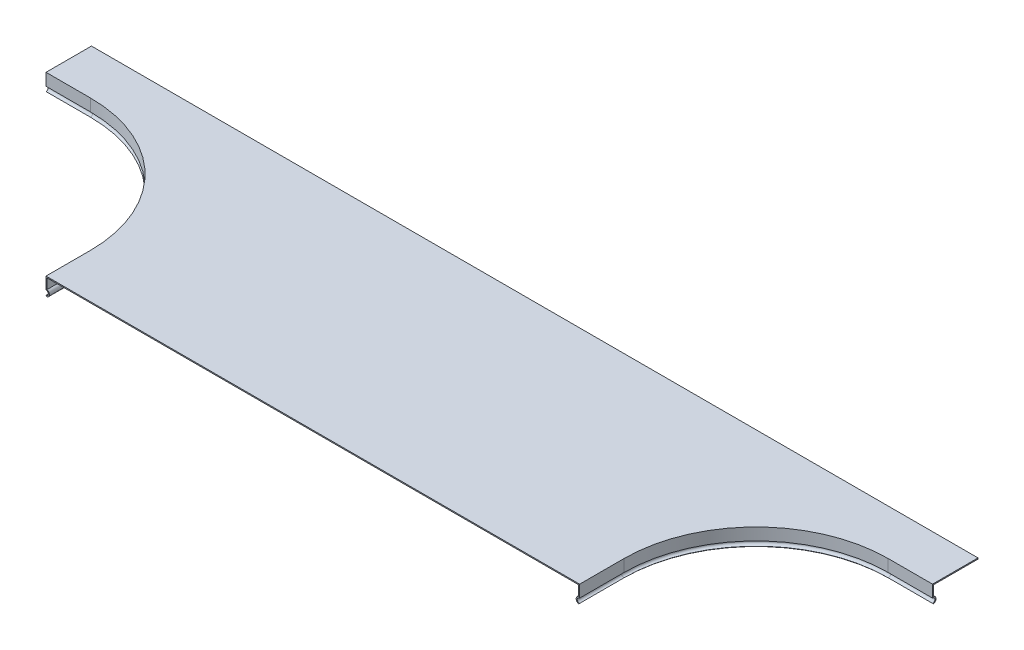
SolidWorks part; units mm, degrees
ref_plane "Front Plane" through (0, 0, 0) normal (0, 0, 1) x (1, 0, 0)
ref_plane "Top Plane" through (0, 0, 0) normal (0, 1, 0) x (1, 0, 0)
ref_plane "Right Plane" through (0, 0, 0) normal (1, 0, 0) x (0, 0, -1)
sketch "Sketch1" plane through (0, 0, 0) normal (0, 1, 0) x (1, 0, 0)
  line L0 (0, 0) -> (0, 50)
  line L1 (150, 200) -> (200, 200)
  arc A0 (0, 50) -> (150, 200) centre (150, 50) cw
  dimension "D2" = 150
  dimension "D1" = 50
sketch "Sketch2" plane through (0, 0, 0) normal (0, 0, 1) x (1, 0, 0)
  line L0 (0, 0) -> (0, -11.3622)
  line L1 (0, 0) -> (-298.786, 0)
  line L3 (-298.786, 0) -> (-298.786, 1.214)
  line L4 (-298.786, 1.214) -> (1.214, 1.214)
  line L5 (1.214, 1.214) -> (1.214, -12.4333)
  line L6 (1.214, -12.4333) -> (1.214, -36.5404) construction
  line L9 (1.214, -17.5667) -> (0.1123, -18.6684)
  line L10 (-50, 0) -> (-50, -15) construction
  line L11 (-51.214, 1.214) -> (-51.214, -16.5185) construction
  line L12 (1.214, 1.214) -> (-51.214, 1.214) construction
  line L13 (0, 0) -> (-50, 0) construction
  arc A0 (0, -11.3622) -> (0.1123, -18.6684) centre (1.0488, -15) ccw
  arc A3 (1.214, -12.4333) -> (1.214, -17.5667) centre (1.0488, -15) ccw
  arc A4 (-51.214, -16.5185) -> (-50, -21.358) centre (-50, -18.786) cw construction
  arc A5 (1.214, -12.4333) -> (2.9073, -13.222) centre (1.0488, -15) ccw construction
  arc A6 (-50, -15) -> (-50, -22.572) centre (-50, -18.786) cw construction
  arc A7 (0, -11.3622) -> (3.7845, -12.3828) centre (1.0488, -15) ccw construction
  dimension "D4" = 1.214
  dimension "D5" = 3.786
  dimension "D2" = 15
  dimension "D3" = 1.214
  dimension "D6" = 45
  dimension "D1" = 300
sweep "Sweep1" add profiles "Sketch2" path "Sketch1"
sketch "Sketch3" plane through (0, 0, 0) normal (0, 1, 0) x (1, 0, 0)
  line L0 (-298.786, 0) -> (-598.786, 0) construction
  line L1 (-748.786, 200) -> (-798.786, 200)
  line L3 (-598.786, 0) -> (-598.786, 50)
  arc A0 (-598.786, 50) -> (-748.786, 200) centre (-748.786, 50) ccw
  dimension "D2" = 150
  dimension "D1" = 50
  dimension "D3" = 300
sketch "Sketch4" plane through (0, 0, 0) normal (0, 0, 1) x (1, 0, 0)
  line L0 (-598.786, 0) -> (-598.786, -11.4139)
  line L1 (-598.786, 0) -> (-748.786, 0) construction
  line L2 (-298.786, 0) -> (-598.786, 0) construction
  line L3 (-598.786, 0) -> (-298.786, 0)
  line L4 (-298.786, 0) -> (-298.786, 1.214)
  line L5 (-298.786, 1.214) -> (-600, 1.214)
  line L6 (-600, 1.214) -> (-600, -12.428)
  line L7 (-600, -17.572) -> (-598.938, -18.634)
  line L8 (-600, -12.428) -> (-600, -31.5018) construction
  arc A0 (-598.786, -11.4139) -> (-598.938, -18.634) centre (-600, -15) cw
  arc A1 (-600, -12.428) -> (-600, -17.572) centre (-600, -15) cw
  dimension "D3" = 1.214
  dimension "D6" = 3.786
  dimension "D1" = 300
  dimension "D2" = 1.214
  dimension "D4" = 45
  dimension "D5" = 15
sweep "Sweep2" add profiles "Sketch4" path "Sketch3"
sketch "Sketch5" plane through (0, 1.214, 0) normal (0, 1, 0) x (1, 0, 0)
  line L0 (-798.393, 198.786) -> (-798.393, 250)
  line L1 (-299.393, 250) -> (-299.393, 48.786) construction
  line L2 (-798.393, 250) -> (199.607, 250)
  line L4 (199.607, 250) -> (199.607, 198.786)
  line L5 (199.607, 198.786) -> (-254.393, 198.786)
  line L6 (-299.393, 48.786) -> (-299.393, 0) construction
  line L7 (1.214, 0) -> (-600, 0) construction
  line L8 (150, 198.786) -> (200, 198.786) construction
  line L9 (-254.393, 198.786) -> (-254.393, 48.786)
  line L10 (-254.393, 48.786) -> (-299.393, 48.786)
  line L11 (-344.393, 48.786) -> (-344.393, 198.786)
  line L12 (-299.393, 48.786) -> (-344.393, 48.786)
  line L13 (-344.393, 198.786) -> (-798.393, 198.786)
  dimension "D1" = 998
  dimension "D2" = 250
  dimension "D3" = 150
  dimension "D4" = 45
extrude "Extrude1" add sketch "Sketch5" against normal blind 1.214
sketch "Sketch7" [suppressed] plane through (0, 1.214, 0) normal (0, 1, 0) x (1, 0, 0)
  line L0 (-198.786, 180) -> (-328.7871, 180)
  line L3 (-198.786, 180) -> (130.0025, 180)
extrude "Extrude2" [suppressed] cut sketch "Sketch7" against normal through all and the other way through all
sketch "Sketch8" [suppressed] plane through (0, 1.214, 0) normal (0, 1, 0) x (1, 0, 0)
  line L0 (-198.786, 180) -> (-428.786, 180)
  line L1 (-428.786, 280) -> (-428.786, 128.786) construction
  line L2 (-198.786, 180) -> (130, 180)
  line L3 (130, 128.786) -> (130, 278.786) construction
extrude "Extrude3" [suppressed] cut sketch "Sketch8" against normal through all and the other way through all
sketch "Sketch9" [suppressed] plane through (0, 1.214, 0) normal (0, 1, 0) x (1, 0, 0)
  line L0 (-302.3758, 250) -> (-698.786, 250)
  line L1 (-698.786, 450) -> (-698.786, 198.786) construction
  line L2 (-302.3758, 250) -> (200, 250)
  line L3 (200, 198.786) -> (200, 448.786) construction
extrude "Extrude4" [suppressed] cut sketch "Sketch9" against normal through all and the other way through all
sketch "Sketch10" plane through (0, 1.214, 0) normal (0, 1, 0) x (1, 0, 0)
  line L0 (-345.6731, 250) -> (-798.786, 250)
  line L1 (-798.786, 500) -> (-798.786, 198.786) construction
  line L2 (-345.6731, 250) -> (200, 250)
  line L3 (200, 198.786) -> (200, 498.786) construction
extrude "Extrude5" cut sketch "Sketch10" against normal through all and the other way through all
